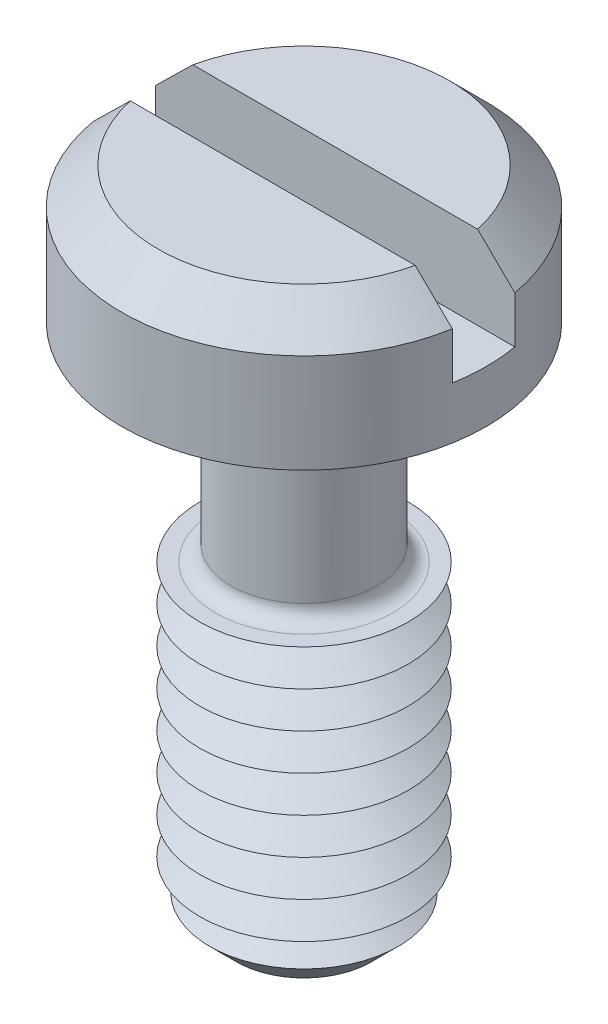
SolidWorks part; units mm, degrees
ref_plane "Front Plane" through (0, 0, 0) normal (0, 0, 1) x (1, 0, 0)
ref_plane "Top Plane" through (0, 0, 0) normal (0, 1, 0) x (1, 0, 0)
ref_plane "Right Plane" through (0, 0, 0) normal (1, 0, 0) x (0, 0, -1)
sketch "Sketch1" plane through (0, 0, 0) normal (0, 1, 0) x (1, 0, 0)
  circle A0 centre (0, 0) radius 3.5
  dimension "D1" = 7
extrude "Boss-Extrude1" add sketch "Sketch1" along normal blind 2.6
sketch "Sketch2" plane through (0, 0, 0) normal (0, -1, 0) x (1, 0, 0)
  circle A0 centre (0, 0) radius 1.4
  dimension "D1" = 2.8
extrude "Boss-Extrude2" add sketch "Sketch2" along normal blind 10
sketch "Sketch3" plane through (0, -10, 0) normal (0, -1, 0) x (1, 0, 0)
  circle A0 centre (0, 0) radius 2
  dimension "D1" = 4
extrude "Boss-Extrude3" add sketch "Sketch3" against normal blind 6
chamfer "Chamfer1" distance 0.7 angle 45 1 edges at (0, -10, -2)
sketch "Sketch4" plane through (0, 0, 0) normal (1, 0, 0) x (0, 0, -1)
  line L0 (0, -6.5871) -> (0, -12.0372) construction
sketch "Sketch5" plane through (0, 0, 0) normal (1, 0, 0) x (0, 0, -1)
  line L0 (-2, -4) -> (-1.3938, -4.35)
  line L1 (-1.3938, -4.35) -> (-2, -4.7)
  line L2 (-2, -4) -> (-2, -9.3) construction
  line L3 (-2, -4.7) -> (-2, -4)
  dimension "D1" = 0.7
revolve "Cut-Revolve1" cut sketch "Sketch5" angle 360 about L0
pattern_linear "LPattern1" count 8 spacing 0.7 along (0, -1, 0) of "Cut-Revolve1"
fillet "Fillet1" radius 0.3 2 edges at (0, -4, -1.4) (0, 0, -1.4)
chamfer "Chamfer2" distance 0.7 angle 45 1 edges at (0, 2.6, 3.5)
sketch "Sketch6" plane through (0, 2.6, 0) normal (0, 1, 0) x (1, 0, 0)
  line L1 (3.5, -0.6) -> (-3.5, -0.6)
  line L2 (3.5, -0.6) -> (3.5, 0.6)
  line L3 (3.5, 0.6) -> (-3.5, 0.6)
  line L4 (-3.5, -0.6) -> (-3.5, 0.6)
  line L5 (3.5, -0.6) -> (-3.5, 0.6) construction
  line L6 (3.5, 0.6) -> (-3.5, -0.6) construction
  circle A0 centre (0, 0) radius 3.5 construction
  point P0 (0, 0)
  dimension "D1" = 1.2
extrude "Cut-Extrude1" cut sketch "Sketch6" against normal blind 1.6
